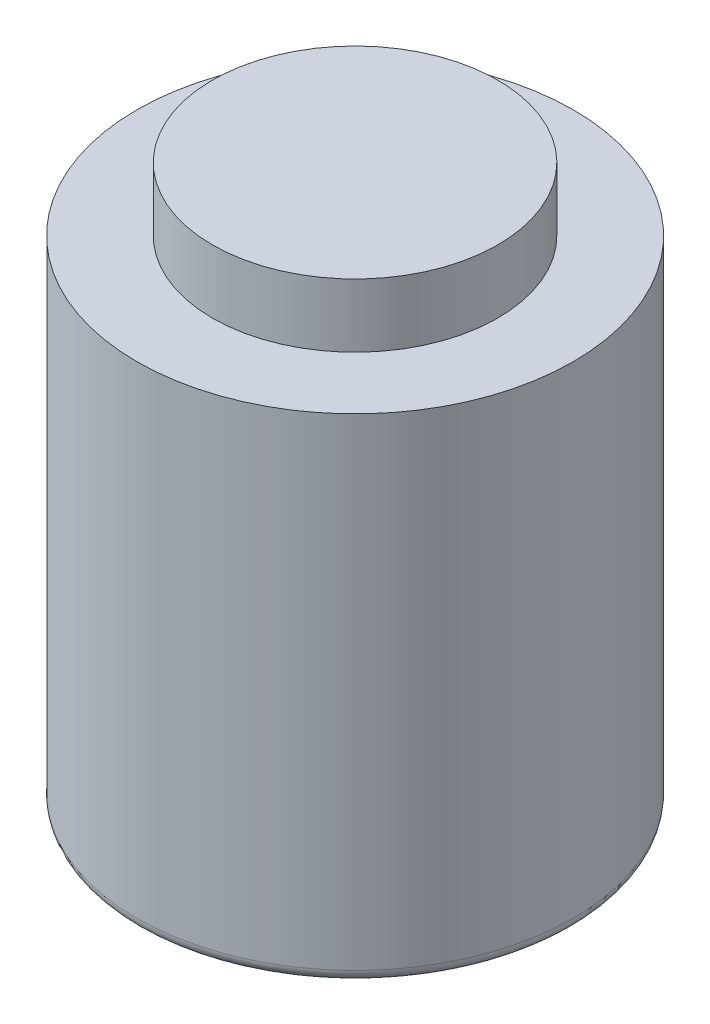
SolidWorks part; units mm, degrees
ref_plane "Plano frontal" through (0, 0, 0) normal (0, 0, 1) x (1, 0, 0)
ref_plane "Plano superior" through (0, 0, 0) normal (0, 1, 0) x (1, 0, 0)
ref_plane "Plano direito" through (0, 0, 0) normal (1, 0, 0) x (0, 0, -1)
sketch "Esboço1" plane through (0, 0, 0) normal (0, 1, 0) x (1, 0, 0)
  circle A0 centre (0, 0) radius 17.2
  dimension "D1" = 34.4
extrude "Ressalto-extrusão1" add sketch "Esboço1" along normal blind 39
sketch "Esboço2" plane through (0, 39, 0) normal (0, 1, 0) x (1, 0, 0)
  circle A0 centre (0, 0) radius 11.25
  dimension "D1" = 22.5
extrude "Ressalto-extrusão2" add sketch "Esboço2" along normal blind 5
sketch "Esboço3" plane through (0, 0, 0) normal (0, -1, 0) x (1, 0, 0)
  circle A0 centre (0, 0) radius 4
  dimension "D1" = 8
extrude "Ressalto-extrusão3" add sketch "Esboço3" along normal blind 3
sketch "Esboço5" plane through (0, -3, 0) normal (0, -1, 0) x (1, 0, 0)
  circle A0 centre (0, 0) radius 1
  dimension "D1" = 2
extrude "Ressalto-extrusão4" add sketch "Esboço5" along normal blind 7
sketch "Esboço6" plane through (0, 0, 0) normal (0, -1, 0) x (1, 0, 0)
  circle A0 centre (0, 0) radius 13.5 construction
  point P3 (0, 13.5)
  dimension "D1" = 27
hole_wizard "Furo roscado de M2.51" positions "3DSketch1" profile "Esboço7" tap size "M2.5" standard "ISO"
sketch3d "3DSketch1"
  point P0 (0, 0, 13.5)
sketch "Esboço7" plane through (0, 0, 13.5) normal (1, 0, 0) x (0, 0, -1)
  line L0 (0, 0) -> (0, 6)
  line L1 (0, 6) -> (1.025, 5.3841)
  line L2 (1.025, 5.3841) -> (1.025, 0)
  line L5 (1.025, 0) -> (0, 0)
  line L10 (0, 6) -> (-1.025, 5.3841) construction
  line L11 (0, -6.35) -> (0, 107.95) construction
  dimension "Tap Drill Dia." = 2.05
  dimension "Tap Drill Depth" = 6
  dimension "Drill Angle" = 118
pattern_circular "PadrãoCircular1" count 6 over 360 about axis through (0, 0, 0) along (0, 1, 0) of "Furo roscado de M2.51"
fillet "Filete1" radius 1 1 edges at (0, 0, 17.2)
